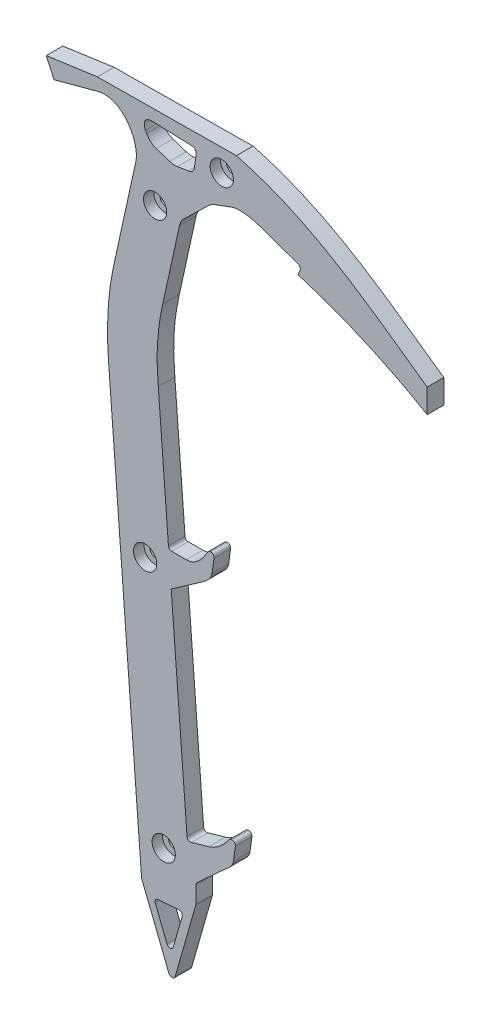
SolidWorks part; units mm, degrees
ref_plane "Front Plane" through (0, 0, 0) normal (0, 0, 1) x (1, 0, 0)
ref_plane "Top Plane" through (0, 0, 0) normal (0, 1, 0) x (1, 0, 0)
ref_plane "Right Plane" through (0, 0, 0) normal (1, 0, 0) x (0, 0, -1)
other "Bounding Box"
ref_plane "Default Plane" through (-85.2228, 232.448, 0) normal (0.9878, 0.1558, 0) x (0, 0, -1)
sketch "Sketch2" plane through (0, 0, 0) normal (0, 0, 1) x (1, 0, 0)
  line L0 (31.0095, -409.0266) -> (50.3129, 200.2677) construction
  line L1 (44.6721, -347.3042) -> (13.607, 57.9067) construction
  line L2 (6.6836, -350.2166) -> (44.6721, -347.3042) construction
  line L3 (-24.3815, 54.9944) -> (6.6836, -350.2166)
  line L4 (33.3675, 188.6776) -> (17.033, 114.249)
  line L5 (-3.5959, 197.9884) -> (-20.611, 120.4586)
  line L6 (-33.0001, 230.1938) -> (-66.1198, 221.2764)
  line L7 (-78.5559, 217.928) -> (-85.2148, 232.4492) construction
  line L8 (-33.0001, 239.7742) -> (73.4154, 240.7486)
  line L9 (-72.0877, 234.2908) -> (-33.0001, 239.7742)
  line L10 (38.1922, 193.0982) -> (70.0858, 204.9113)
  line L11 (219.3152, 142.1325) -> (219.3152, 160.4223)
  line L12 (219.3152, 142.1325) -> (120.4435, 185.4637) construction
  line L13 (120.4435, 185.4637) -> (123.1802, 191.7081)
  line L14 (123.1802, 191.7081) -> (90.0064, 203.3731)
  line L15 (9.9641, 231.3514) -> (39.2147, 230.1938)
  line L16 (3.9087, 222.8328) -> (10.3233, 210.1062)
  line L17 (42.6016, 226.4763) -> (41.2161, 216.4695)
  line L18 (14.0181, 208.772) -> (36.5462, 212.2102)
  line L19 (27.4053, -122.0771) -> (13.607, 57.9067)
  line L20 (48.1647, -347.0365) -> (30.3446, -409.6333)
  line L21 (30.3446, -409.6333) -> (6.6836, -350.2166)
  line L22 (27.4053, -122.0771) -> (40.9199, -122.0771)
  line L23 (62.4635, -107.5319) -> (60.6474, -121.0144)
  line L24 (29.3333, -147.226) -> (52.7557, -130.9017)
  line L25 (62.4635, -107.5319) -> (58.0169, -107.5319)
  line L26 (29.3333, -147.226) -> (41.6789, -308.2607)
  line L27 (25.6779, -348.7604) -> (30.3446, -409.6333) construction
  line L28 (15.9069, -358.2248) -> (38.6961, -356.4777)
  line L29 (15.9069, -358.2248) -> (28.906, -390.8676)
  line L30 (28.906, -390.8676) -> (38.6961, -356.4777)
  line L31 (-72.0877, 234.2908) -> (-66.1198, 221.2764)
  line L32 (48.1647, -332.6989) -> (48.1647, -347.0365)
  line L33 (-85.2148, 232.4492) -> (-72.0877, 234.2908) construction
  line L34 (41.6789, -308.2607) -> (58.0169, -303.5819)
  line L35 (78.7824, -290.1774) -> (76.9664, -303.6598)
  line L36 (48.1647, -332.6989) -> (69.0747, -313.5472)
  line L37 (78.7824, -290.1774) -> (74.3358, -290.1774)
  line L38 (-66.1198, 221.2764) -> (-78.5559, 217.928) construction
  spline S0 degree 3 poles (-24.3815, 54.9944) (-26.1546, 78.1223) (-25.1036, 99.9878) (-20.611, 120.4586) knots 0 0 0 0 1 1 1 1
  spline S1 degree 3 poles (17.033, 114.249) (11.9648, 91.1558) (12.1688, 76.6671) (13.607, 57.9067) knots 0 0 0 0 1 1 1 1
  spline S2 degree 3 poles (-33.0001, 230.1938) (-27.1367, 231.7726) (-14.9868, 229.4205) (-4.2882, 214.5639) (-2.5291, 202.8493) (-3.5959, 197.9884) knots 0 0 0 0 0.318927 0.707776 1 1 1 1
  spline S3 degree 3 poles (33.3675, 188.6776) (33.8997, 191.1028) (36.1468, 192.3406) (38.1922, 193.0982) knots 0 0 0 0 1 1 1 1
  spline S4 degree 3 poles (219.3152, 160.4223) (171.7359, 194.0829) (130.1784, 225.9646) (73.4154, 240.7486) knots 0 0 0 0 1 1 1 1
  spline S5 degree 2 poles (219.3152, 142.1325) (171.6775, 170.1277) (120.4435, 185.4637) knots 0 0 0 1 1 1
  spline S6 degree 3 poles (70.0858, 204.9113) (74.2686, 206.4606) (83.7236, 205.5824) (90.0064, 203.3731) knots 0 0 0 0 1 1 1 1
  spline S7 degree 3 poles (3.9087, 222.8328) (2.3406, 225.9438) (1.8537, 231.6724) (9.9641, 231.3514) knots 0 0 0 0 1 1 1 1
  spline S8 degree 3 poles (39.2147, 230.1938) (41.862, 230.0891) (42.8331, 228.1483) (42.6016, 226.4763) knots 0 0 0 0 1 1 1 1
  spline S9 degree 3 poles (10.3233, 210.1062) (10.9127, 208.9369) (12.1452, 208.4861) (14.0181, 208.772) knots 0 0 0 0 1 1 1 1
  spline S10 degree 3 poles (36.5462, 212.2102) (39.4356, 212.6512) (40.9271, 214.3826) (41.2161, 216.4695) knots 0 0 0 0 1 1 1 1
  spline S11 degree 2 poles (58.0169, -107.5319) (50.1965, -122.0771) (40.9199, -122.0771) knots 0 0 0 1 1 1
  spline S12 degree 3 poles (60.6474, -121.0144) (60.0315, -125.5867) (56.2153, -128.4905) (52.7557, -130.9017) knots 0 0 0 0 1 1 1 1
  spline S15 degree 2 poles (74.3358, -290.1774) (66.935, -301.028) (58.0169, -303.5819) knots 0 0 0 1 1 1
  spline S16 degree 3 poles (76.9664, -303.6598) (76.3505, -308.2322) (72.1843, -310.699) (69.0747, -313.5472) knots 0 0 0 0 1 1 1 1
  dimension "D1" = 609.6
  dimension "D2" = 38.1
  dimension "D3" = 406.4
  dimension "D4" = 406.4
  dimension "D5" = 76.2
  dimension "D6" = 79.375
  dimension "D7" = 38.1
  dimension "D8" = 107.95
  dimension "D9" = 18.2898
  dimension "D10" = 12.7
extrude "Boss-Extrude1" add sketch "Sketch2" along normal blind 12.7
fillet "Fillet1" radius 2.54 15 edges at (123.1802, 191.7081, 6.35) (-33.0001, 239.7742, 6.35) (6.6836, -350.2166, 6.35) (30.3446, -409.6333, 6.35) (48.1647, -347.0365, 6.35) (48.1647, -332.6989, 6.35) (41.6789, -308.2607, 6.35) (74.3358, -290.1774, 6.35) (78.7824, -290.1774, 6.35) (27.4053, -122.0771, 6.35) (58.0169, -107.5319, 6.35) (62.4635, -107.5319, 6.35) (28.906, -390.8676, 6.35) (15.9069, -358.2248, 6.35) (38.6961, -356.4777, 6.35)
sketch "Sketch7" plane through (0, 0, 12.7) normal (0, 0, 1) x (1, 0, 0)
  line L0 (-21.7757, 21.0043) -> (-15.951, -54.9727)
  line L1 (-21.7757, 21.0043) -> (16.2128, 23.9167)
  line L2 (-15.951, -54.9727) -> (22.0375, -52.0604)
  line L3 (16.2128, 23.9167) -> (22.0375, -52.0604)
  line L7 (27.2255, -119.7313) -> (13.607, 57.9067) construction
  line L10 (35.0607, -356.7564) -> (19.3502, -357.9608) construction
  line L11 (-24.3815, 54.9944) -> (6.654, -349.8306) construction
  dimension "D1" = 76.2
  dimension "D2" = 304.8
extrude "Cut-Extrude2" cut sketch "Sketch7" against normal through all both and the other way through all
move or copy body "Body-Move/Copy1" bodies to move or copy 104 copy no translate (5.8247, -75.9771, 0)
combine bodies "Combine1" operation type add bodies to combine 106 110
sketch "Sketch8" plane through (0, 0, 12.7) normal (0, 0, 1) x (1, 0, 0)
  line L0 (12.9407, 140.4925) -> (31.1069, 134.5141)
  line L1 (9.7334, 146.8558) -> (16.148, 134.1292) construction
  line L2 (19.8428, 132.7949) -> (42.3709, 136.2332) construction
  line L3 (19.8428, 132.7949) -> (31.1069, 134.5141)
  line L4 (12.9407, 140.4925) -> (16.148, 134.1292)
  line L5 (59.9637, 123.0277) -> (36.4698, 100.2958)
  line L6 (44.0169, 117.1211) -> (75.9105, 128.9343) construction
  line L7 (22.8577, 38.2719) -> (39.1922, 112.7006) construction
  line L8 (36.4698, 100.2958) -> (39.1922, 112.7006)
  line L9 (44.0169, 117.1211) -> (59.9637, 123.0277)
  spline S0 degree 3 poles (1484.1796, 1485.4007) (-460.001, 60.0598) (-405.8009, -749.5395) (1246.2208, 1709.7648) knots -27.50692 -27.50692 -27.50692 -27.50692 25.241817 25.241817 25.241817 25.241817 only from (16.148, 134.1292) to (19.8428, 132.7949) construction
  spline S1 degree 3 poles (16.148, 134.1292) (16.7374, 132.9599) (17.9699, 132.5091) (19.8428, 132.7949) knots 0 0 0 0 1 1 1 1
  spline S2 degree 3 poles (1839.0207, -757.1988) (-1871.9811, 864.5832) (1999.0847, -533.9288) (-1868.3496, 702.148) knots -9.000867 -9.000867 -9.000867 -9.000867 10.994632 10.994632 10.994632 10.994632 only from (39.1922, 112.7006) to (44.0169, 117.1211) construction
  spline S3 degree 3 poles (39.1922, 112.7006) (39.7245, 115.1258) (41.9715, 116.3635) (44.0169, 117.1211) knots 0 0 0 0 1 1 1 1
  dimension "D1" = 12.7
extrude "Boss-Extrude2" add sketch "Sketch8" against normal up to surface (12.7 mm away) contours L5 L8 S3 L9
fillet "Fillet2" radius 12.7 4 edges at (59.9637, 123.0277, 6.35) (36.4698, 100.2958, 6.35) (31.1069, 134.5141, 6.35) (12.9407, 140.4925, 6.35)
hole_wizard "CBORE for 5/16 Binding Head Machine Screw1" positions "Sketch9" profile "Sketch11" counterbore size "5/16" standard "ANSI Inch"
sketch "Sketch9" plane through (0, 0, 12.7) normal (0, 0, 1) x (1, 0, 0)
  point P0 (68.0092, 147.7417)
  point P3 (17.0415, 100.6382)
  point P6 (9.3819, -136.1974)
  point P9 (23.6115, -321.8072)
sketch "Sketch11" plane through (68.0092, 147.7417, 12.7) normal (1, 0, 0) x (0, -1, 0)
  line L0 (0, 0) -> (0, 12.7)
  line L1 (0, 12.7) -> (4.2164, 12.7)
  line L3 (4.2164, 12.7) -> (4.2164, 7.9375)
  line L4 (4.2164, 7.9375) -> (8.89, 7.9375)
  line L5 (8.89, 7.9375) -> (8.89, 0)
  line L7 (8.89, 0) -> (0, 0)
  line L11 (0, -6.35) -> (0, 107.95) construction
  dimension "Thru Hole Dia." = 8.4328
  dimension "Thru Hole Depth" = 12.7
  dimension "C'Bore Dia." = 17.78
  dimension "C'Bore Depth" = 7.9375
